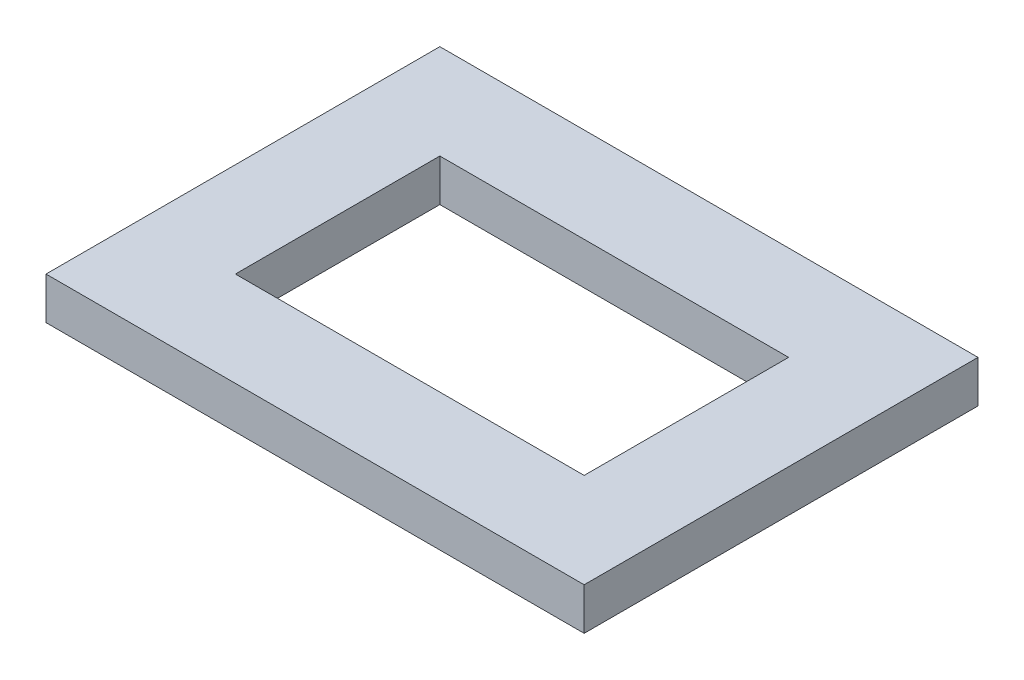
SolidWorks part; units mm, degrees
ref_plane "Front Plane" through (0, 0, 0) normal (0, 0, 1) x (1, 0, 0)
ref_plane "Top Plane" through (0, 0, 0) normal (0, 1, 0) x (1, 0, 0)
ref_plane "Right Plane" through (0, 0, 0) normal (1, 0, 0) x (0, 0, -1)
sketch "Sketch1" plane through (0, 0, 0) normal (0, 1, 0) x (1, 0, 0)
  line L1 (92.075, -53.975) -> (-92.075, -53.975)
  line L2 (92.075, -53.975) -> (92.075, 53.975)
  line L3 (92.075, 53.975) -> (-92.075, 53.975)
  line L4 (-92.075, -53.975) -> (-92.075, 53.975)
  line L5 (92.075, -53.975) -> (-92.075, 53.975) construction
  line L6 (92.075, 53.975) -> (-92.075, -53.975) construction
  line L7 (142.075, -103.975) -> (-142.075, -103.975)
  line L8 (142.075, -103.975) -> (142.075, 103.975)
  line L9 (142.075, 103.975) -> (-142.075, 103.975)
  line L10 (-142.075, -103.975) -> (-142.075, 103.975)
  line L11 (142.075, -103.975) -> (-142.075, 103.975) construction
  line L12 (142.075, 103.975) -> (-142.075, -103.975) construction
  point P0 (0, 0)
  point P6 (0, 0)
  dimension "D1" = 107.95
  dimension "D2" = 184.15
  dimension "D3" = 50
  dimension "D4" = 50
extrude "Boss-Extrude1" add sketch "Sketch1" along normal blind 22.225
